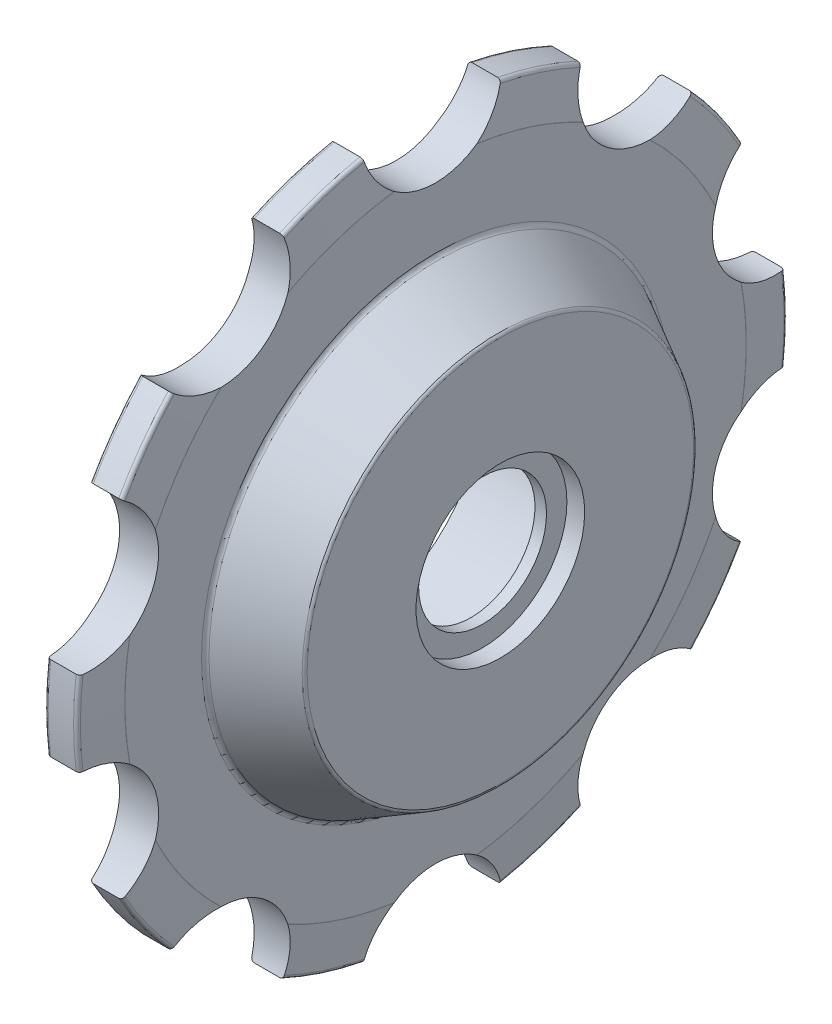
SolidWorks part; units mm, degrees
ref_plane "Plan1" through (0, 0, 0) normal (0, 0, 1) x (1, 0, 0)
ref_plane "Plan2" through (0, 0, 0) normal (0, 1, 0) x (1, 0, 0)
ref_plane "Plan3" through (0, 0, 0) normal (1, 0, 0) x (0, 0, -1)
sketch "Esquisse1" plane through (0, 0, 0) normal (0, 0, 1) x (1, 0, 0)
  line L0 (-4.1973, 3.6) -> (-4.1973, 11)
  line L1 (-4.1973, 11) -> (-1.3973, 13)
  line L2 (-1.3973, 13) -> (-1.3973, 17.5)
  line L3 (-1.3973, 17.5) -> (-1.1973, 20)
  line L4 (-1.1973, 20) -> (0.6027, 20)
  line L5 (0.6027, 20) -> (0.8027, 17.5)
  line L6 (0.8027, 17.5) -> (0.8027, 13)
  line L7 (0.8027, 13) -> (4.4527, 11)
  line L8 (4.4527, 11) -> (4.4527, 3.6)
  line L9 (4.4527, 3.6) -> (-4.1973, 3.6)
  line L10 (-15, 0) -> (15.4, 0) construction
  dimension "D1" = 8.65
  dimension "D2" = 2.2
  dimension "D3" = 1.8
  dimension "D4" = 5
  dimension "D5" = 3.6
  dimension "D6" = 0.2
  dimension "D7" = 20
  dimension "D8" = 11
  dimension "D9" = 11
  dimension "D10" = 13
  dimension "D11" = 13
  dimension "D12" = 2.5
  dimension "D13" = 2.5
revolve "Base-Révolution" add sketch "Esquisse1" angle 360 about L10
sketch "Esquisse2" plane through (0.8027, 0, 0) normal (1, 0, 0) x (0, 0, -1)
  circle A0 centre (0, 20.6) radius 4
  circle A1 centre (12.1084, 16.6658) radius 4
  circle A2 centre (19.5918, 6.3658) radius 4
  circle A3 centre (19.5918, -6.3658) radius 4
  circle A4 centre (12.1084, -16.6658) radius 4
  circle A5 centre (0, -20.6) radius 4
  circle A6 centre (-12.1084, -16.6658) radius 4
  circle A7 centre (-19.5918, -6.3658) radius 4
  circle A8 centre (-19.5918, 6.3658) radius 4
  circle A9 centre (-12.1084, 16.6658) radius 4
  dimension "D1" = 8
  dimension "D2" = 20.6
extrude "Enlèv. mat.-Extru.1" cut sketch "Esquisse2" against normal through all
fillet "Congé1" radius 0.3
fillet "Congé2" radius 0.2
fillet "Congé3" radius 0.3
fillet "Congé4" radius 0.2
sketch "Esquisse3" plane through (4.4527, 0, 0) normal (1, 0, 0) x (0, 0, -1)
  circle A0 centre (0, 0) radius 4.75
  dimension "D1" = 9.5
extrude "Enlèv. mat.-Extru.2" cut sketch "Esquisse3" against normal blind 1
sketch "Esquisse4" plane through (-4.1973, 0, 0) normal (-1, 0, 0) x (0, 0, 1)
  circle A0 centre (0, 0) radius 6.5
  dimension "D1" = 13
extrude "Enlèv. mat.-Extru.3" cut sketch "Esquisse4" against normal blind 7
sketch "Esquisse5" plane through (-4.1973, 0, 0) normal (-1, 0, 0) x (0, 0, 1)
  circle A0 centre (0, 0) radius 7.75
  dimension "D1" = 15.5
extrude "Enlèv. mat.-Extru.4" cut sketch "Esquisse5" against normal blind 5.3
